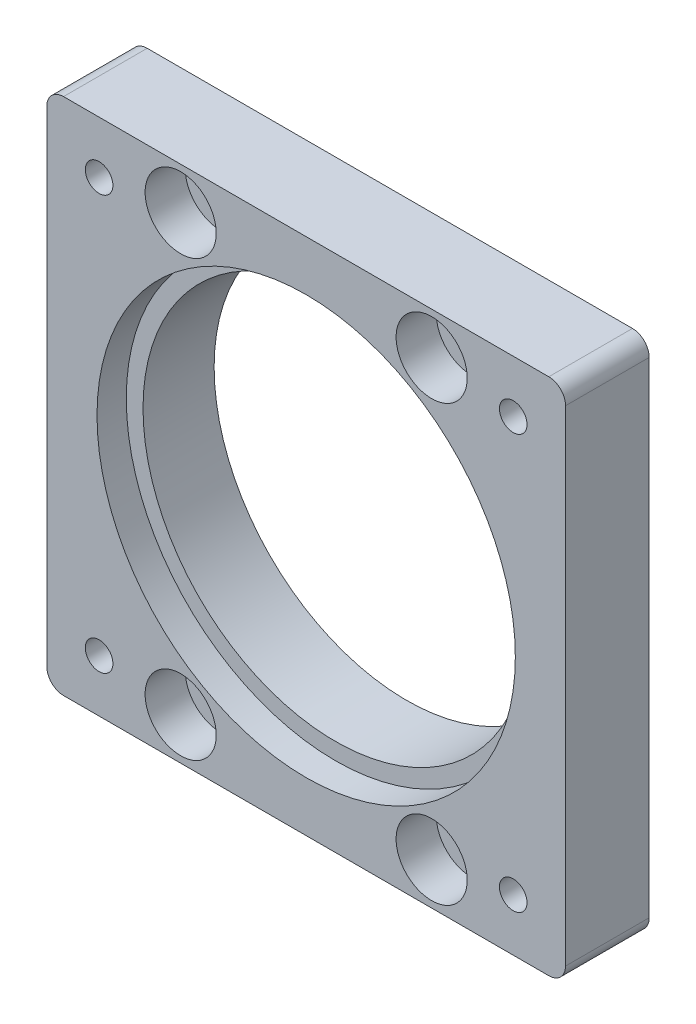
SolidWorks part; units mm, degrees
ref_plane "前视基准面" through (0, 0, 0) normal (0, 0, 1) x (1, 0, 0)
ref_plane "上视基准面" through (0, 0, 0) normal (0, 1, 0) x (1, 0, 0)
ref_plane "右视基准面" through (0, 0, 0) normal (1, 0, 0) x (0, 0, -1)
sketch "草图1" plane through (0, 0, 0) normal (0, 0, 1) x (1, 0, 0)
  line L1 (-31, -31) -> (31, -31)
  line L2 (-31, -31) -> (-31, 31)
  line L3 (-31, 31) -> (31, 31)
  line L4 (31, -31) -> (31, 31)
  line L5 (-31, -31) -> (31, 31) construction
  line L6 (-31, 31) -> (31, -31) construction
  circle A0 centre (0, 0) radius 23
  point P0 (0, 0)
  dimension "D3" = 46
  dimension "D1" = 62
  dimension "D2" = 62
extrude "凸台-拉伸1" add sketch "草图1" along normal blind 10
sketch "草图2" plane through (0, 0, 10) normal (0, 0, 1) x (1, 0, 0)
  line L0 (0, 31) -> (0, 0) construction
  line L1 (31, 31) -> (-31, 31) construction
  line L2 (0, 0) -> (-31, 0) construction
  line L3 (-31, 31) -> (-31, -31) construction
  line L4 (-24.7487, 24.7487) -> (24.7487, -24.7487) construction
  line L5 (24.7487, 24.7487) -> (-24.7487, -24.7487) construction
  circle A0 centre (-24.7487, 24.7487) radius 1.25
  circle A1 centre (24.7487, 24.7487) radius 1.25
  circle A2 centre (24.7487, -24.7487) radius 1.25
  circle A3 centre (-24.7487, -24.7487) radius 1.25
  circle A4 centre (0, 0) radius 35 construction
  dimension "D1" = 70
  dimension "D2" = 45
  dimension "D3" = 2.5
  dimension "D4" = 45
extrude "切除-拉伸1" cut sketch "草图2" against normal through all
sketch "草图3" plane through (0, 0, 10) normal (0, 0, 1) x (1, 0, 0)
  circle A0 centre (0, 0) radius 25
  dimension "D1" = 50
extrude "切除-拉伸2" cut sketch "草图3" against normal blind 3.5
sketch "草图5" plane through (0, 0, 10) normal (0, 0, 1) x (1, 0, 0)
  line L0 (0, 30) -> (0, 0) construction
  line L1 (0, 0) -> (-30, 0) construction
  line L2 (-15, 25.9808) -> (15, -25.9808) construction
  line L3 (15, 25.9808) -> (-15, -25.9808) construction
  circle A0 centre (0, 0) radius 30 construction
  circle A1 centre (-15, 25.9808) radius 2.25
  circle A2 centre (15, 25.9808) radius 2.25
  circle A3 centre (15, -25.9808) radius 2.25
  circle A4 centre (-15, -25.9808) radius 2.25
  dimension "D3" = 60
  dimension "D4" = 4.5
  dimension "D1" = 30
  dimension "D2" = 30
extrude "切除-拉伸3" cut sketch "草图5" against normal through all
sketch "草图6" plane through (0, 0, 10) normal (0, 0, 1) x (1, 0, 0)
  circle A0 centre (-15, 25.9808) radius 4.25
  circle A1 centre (15, 25.9808) radius 4.25
  circle A2 centre (15, -25.9808) radius 4.25
  circle A3 centre (-15, -25.9808) radius 4.25
  dimension "D1" = 8.5
extrude "切除-拉伸4" cut sketch "草图6" against normal blind 4.8
fillet "圆角1" radius 2 4 edges at (-31, 31, 5) (-31, -31, 5) (31, -31, 5) (31, 31, 5)
sketch "草图7" plane through (0, 0, 0) normal (0, 0, -1) x (-1, 0, 0)
  circle A0 centre (0, 0) radius 25 construction
  circle A1 centre (0, 0) radius 23 construction
  circle A2 centre (0, 0) radius 25
  circle A3 centre (0, 0) radius 23
extrude "凸台-拉伸2" add sketch "草图7" along normal blind 2
hole_wizard "M4 螺纹孔2" positions "草图11" profile "草图10" tap size "M4" standard "GB"
sketch "草图11" plane through (0, 0, 10) normal (0, 0, 1) x (1, 0, 0)
  point P0 (24.7487, 24.7487)
  point P3 (24.7487, -24.7487)
  point P6 (-24.7487, 24.7487)
  point P9 (-24.7487, -24.7487)
sketch "草图10" plane through (24.7487, 24.7487, 10) normal (1, 0, 0) x (0, -1, 0)
  line L0 (0, 0) -> (0, 14.3914)
  line L1 (0, 14.3914) -> (1.65, 13.4)
  line L2 (1.65, 13.4) -> (1.65, 0)
  line L5 (1.65, 0) -> (0, 0)
  line L10 (0, 14.3914) -> (-1.65, 13.4) construction
  line L11 (0, -6.35) -> (0, 107.95) construction
  dimension "螺纹孔钻头直径" = 3.3
  dimension "螺纹孔钻头深度" = 13.4
  dimension "导头角度" = 118
